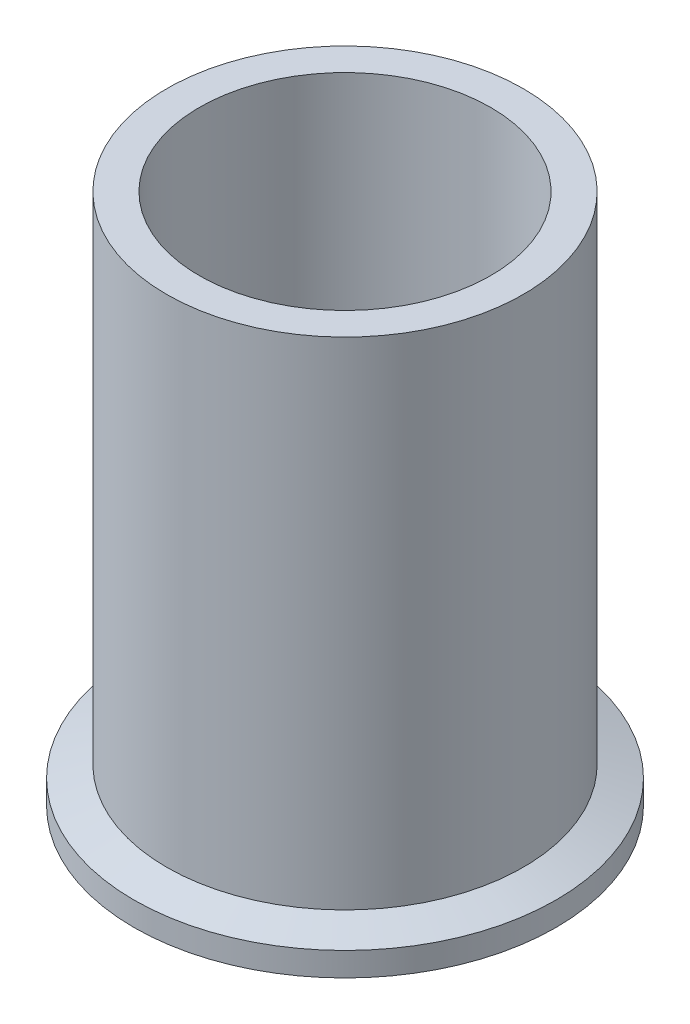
SolidWorks part; units mm, degrees
ref_plane "Front Plane" through (0, 0, 0) normal (0, 0, 1) x (1, 0, 0)
ref_plane "Top Plane" through (0, 0, 0) normal (0, 1, 0) x (1, 0, 0)
ref_plane "Right Plane" through (0, 0, 0) normal (1, 0, 0) x (0, 0, -1)
sketch "Sketch1" plane through (0, 0, 0) normal (0, 0, 1) x (1, 0, 0)
  line L0 (0, 0) -> (0, 63.5) construction
  line L1 (0, 63.5) -> (-21.2852, 63.5)
  line L2 (-21.2852, 63.5) -> (-21.2852, 4.2685)
  line L3 (-21.2852, 4.2685) -> (-25.1968, 2.8448)
  line L4 (-25.1968, 2.8448) -> (-25.1968, 0)
  line L5 (-25.1968, 0) -> (-23.6366, 0)
  line L6 (-20.0006, 0) -> (0, 0)
  line L7 (0, 0) -> (0, 63.5)
  line L8 (0, 63.5) -> (-17.399, 63.5)
  line L9 (-17.399, 63.5) -> (-17.399, 0)
  line L10 (-17.399, 0) -> (0, 0)
  line L11 (0, 0) -> (-0.1846, 0.0129)
  arc A0 (-22.9141, 0.4745) -> (-20.7231, 0.4745) centre (-21.8186, 0) cw
  arc A1 (-20.0006, 0) -> (-20.7231, 0.4745) centre (-20.0006, 0.7874) cw
  arc A2 (-22.9141, 0.4745) -> (-23.6366, 0) centre (-23.6366, 0.7874) cw
  point P12 (-20.6248, 0)
  dimension "D6" = 1.1938
  dimension "D7" = 0.7874
  dimension "D1" = 17.399
  dimension "D2" = 2.8448
  dimension "D3" = 25.1968
  dimension "D4" = 70
  dimension "D5" = 21.8186
  dimension "D8" = 3.8862
  dimension "D9" = 63.5
revolve "Revolve2" add sketch "Sketch1" angle 360 about L0
